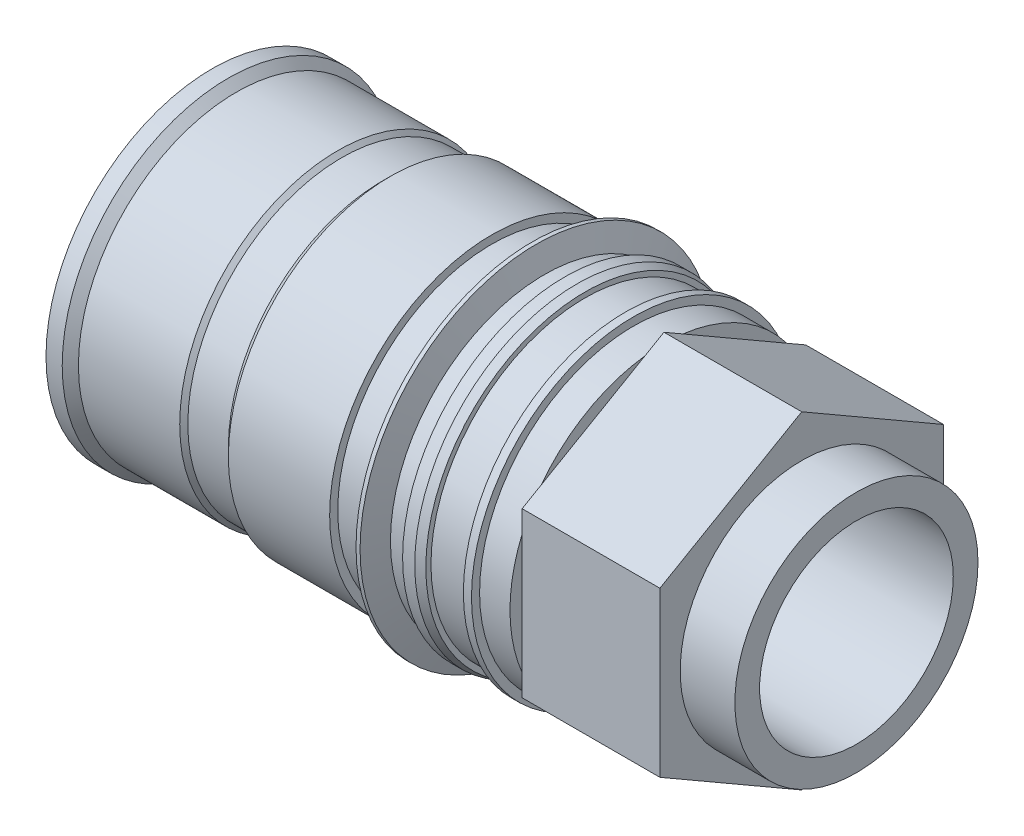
SolidWorks part; units mm, degrees
ref_plane "Alzado" through (0, 0, 0) normal (0, 0, 1) x (1, 0, 0)
ref_plane "Planta" through (0, 0, 0) normal (0, 1, 0) x (1, 0, 0)
ref_plane "Vista lateral" through (0, 0, 0) normal (1, 0, 0) x (0, 0, -1)
sketch "Croquis1" plane through (0, 0, 0) normal (0, 0, 1) x (1, 0, 0)
  line L0 (0, 0) -> (150.0259, 0) construction
  line L1 (0, 0) -> (0, 41)
  line L2 (0, 41) -> (4, 41)
  line L3 (4, 41) -> (6, 39)
  line L4 (6, 39) -> (31, 39)
  line L5 (31, 39) -> (32, 38)
  line L6 (32, 38) -> (42, 38)
  line L7 (42, 38) -> (44, 40)
  line L8 (44, 40) -> (69, 40)
  line L9 (69, 40) -> (69, 38)
  line L10 (69, 38) -> (77, 38)
  line L11 (77, 38) -> (79, 43.495)
  line L12 (79, 43.495) -> (80, 43.495)
  line L13 (80, 43.495) -> (82, 38)
  line L14 (82, 38) -> (87, 38)
  line L15 (87, 38) -> (87, 40)
  line L16 (87, 40) -> (90, 40)
  line L17 (90, 40) -> (92, 39.2721)
  line L18 (92, 39.2721) -> (92, 38)
  line L19 (92, 38) -> (102, 38)
  line L20 (102, 38) -> (102, 40)
  line L21 (102, 40) -> (104, 40)
  line L22 (104, 40) -> (104, 38)
  line L23 (104, 38) -> (111.5, 38)
  line L24 (111.5, 38) -> (111.5, 0)
  line L25 (111.5, 0) -> (0, 0)
  dimension "D1" = 111.5
  dimension "D2" = 82
  dimension "D3" = 4
  dimension "D4" = 135
  dimension "D5" = 2
  dimension "D6" = 25
  dimension "D7" = 1
  dimension "D8" = 10
  dimension "D9" = 2
  dimension "D10" = 25
  dimension "D11" = 2
  dimension "D12" = 8
  dimension "D13" = 2
  dimension "D14" = 110
  dimension "D15" = 1
  dimension "D16" = 2
  dimension "D17" = 5
  dimension "D18" = 2
  dimension "D19" = 3
  dimension "D20" = 10
  dimension "D21" = 2
  dimension "D22" = 2
revolve "Revolución1" add sketch "Croquis1" angle 360 about L0
sketch "Croquis2" plane through (111.5, 0, 0) normal (1, 0, 0) x (0, 0, -1)
  line L1 (0, 40.4145) -> (-35, 20.2073)
  line L2 (-35, 20.2073) -> (-35, -20.2073)
  line L3 (-35, -20.2073) -> (0, -40.4145)
  line L4 (0, -40.4145) -> (35, -20.2073)
  line L5 (35, -20.2073) -> (35, 20.2073)
  line L6 (35, 20.2073) -> (0, 40.4145)
  circle A0 centre (0, 0) radius 35 construction
  dimension "D1" = 70
extrude "Saliente-Extruir1" add sketch "Croquis2" along normal blind 34
sketch "Croquis3" plane through (145.5, 0, 0) normal (1, 0, 0) x (0, 0, -1)
  circle A0 centre (0, 0) radius 30
  dimension "D1" = 60
extrude "Saliente-Extruir2" add sketch "Croquis3" along normal blind 13.5
sketch "Croquis4" plane through (159, 0, 0) normal (1, 0, 0) x (0, 0, -1)
  circle A0 centre (0, 0) radius 23.9
  dimension "D1" = 47.8
extrude "Cortar-Extruir1" cut sketch "Croquis4" against normal through all
